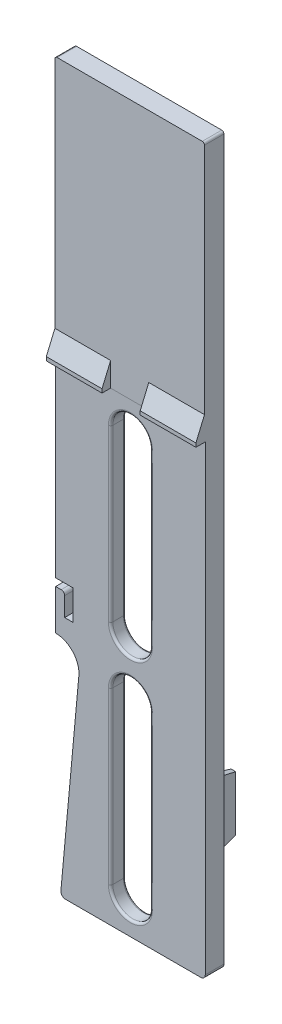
SolidWorks part; units mm, degrees
ref_plane "Front Plane" through (0, 0, 0) normal (0, 0, 1) x (1, 0, 0)
ref_plane "Top Plane" through (0, 0, 0) normal (0, 1, 0) x (1, 0, 0)
ref_plane "Right Plane" through (0, 0, 0) normal (1, 0, 0) x (0, 0, -1)
sketch "Sketch1" plane through (0, 0, 0) normal (0, 0, 1) x (1, 0, 0)
  line L0 (0, 0) -> (0, 100.3393) construction
  line L2 (-12.7, 123.19) -> (12.7, 123.19)
  line L3 (-12.7, 123.19) -> (-12.7, 0)
  line L4 (-12.7, 0) -> (12.7, 0)
  line L5 (12.7, 123.19) -> (12.7, 0)
  line L6 (-12.7, 123.19) -> (12.7, 0) construction
  line L7 (-12.7, 0) -> (12.7, 123.19) construction
  point P3 (0, 61.595)
  dimension "D1" = 25.4
  dimension "D2" = 123.19
extrude "Boss-Extrude1" add sketch "Sketch1" against normal blind 2.032
sketch "Sketch2" plane through (0, 0, -2.032) normal (0, 0, -1) x (-1, 0, 0)
  line L4 (-12.7, 123.19) -> (-12.7, 0)
  line L5 (-12.7, 0) -> (12.7, 0)
  line L6 (12.7, 0) -> (12.7, 123.19)
  line L7 (12.7, 123.19) -> (-12.7, 123.19)
  line L8 (-12.7, 123.19) -> (-12.7, 0)
  line L9 (-12.7, 0) -> (12.7, 0)
  line L10 (12.7, 0) -> (12.7, 123.19)
  line L11 (12.7, 123.19) -> (-12.7, 123.19)
  dimension "D1" = 0
extrude "Extrude-Thin1" add sketch "Sketch2" along normal offset from surface (1.143 mm away) 3.175 thin
sketch "Sketch3" plane through (0, 0, 0) normal (0, 0, 1) x (1, 0, 0)
  line L0 (0, 123.19) -> (0, 0) construction
  line L1 (12.7, 123.19) -> (-12.7, 123.19) construction
  line L2 (0, 34.7345) -> (0, 5.8293) construction
  line L3 (3.3655, 34.7345) -> (3.3655, 5.8293)
  line L4 (-3.3655, 34.7345) -> (-3.3655, 5.8293)
  line L5 (-12.7, 0) -> (12.7, 0) construction
  arc A0 (3.3655, 34.7345) -> (-3.3655, 34.7345) centre (0, 34.7345) ccw
  arc A1 (-3.3655, 5.8293) -> (3.3655, 5.8293) centre (0, 5.8293) ccw
  point P7 (0, 20.2819)
  point P12 (0, 0)
  dimension "D3" = 2.4638
  dimension "D1" = 6.731
  dimension "D2" = 35.6362
extrude "Cut-Extrude1" cut sketch "Sketch3" against normal through all
pattern_linear "LPattern1" count 2 spacing 38.608 along (0, 1, 0) of "Cut-Extrude1"
sketch "Sketch4" plane through (0, 0, 0) normal (0, 0, 1) x (1, 0, 0)
  line L0 (-11.8872, 0) -> (-8.763, 33.9877)
  line L1 (-12.7, 0) -> (12.7, 0) construction
  line L2 (-12.7, 38.3032) -> (-22.3348, 38.3032) construction
  line L3 (-12.7, 123.19) -> (-12.7, 0) construction
  line L4 (12.7, 0) -> (12.7, 123.19) construction
  arc A0 (-8.763, 33.9877) -> (-12.7, 38.3032) centre (-12.7, 34.3496) ccw
  dimension "D1" = 24.5872
  dimension "D2" = 38.3032
  dimension "D3" = 21.463
extrude "Cut-Extrude2" cut sketch "Sketch4" against normal through all and the other way through all
sketch "Sketch5" plane through (0, 0, 0) normal (0, 0, 1) x (1, 0, 0)
  line L0 (-12.7, 46.4312) -> (-9.7282, 46.4312)
  line L1 (-12.7, 123.19) -> (-12.7, 38.3032) construction
  line L2 (-9.7282, 46.4312) -> (-9.7282, 41.3512)
  line L3 (-9.7282, 41.3512) -> (-11.176, 41.3512)
  line L4 (-11.176, 41.3512) -> (-11.176, 45.1612)
  line L5 (-11.176, 45.1612) -> (-12.7, 45.1612)
  line L6 (-12.7, 45.1612) -> (-12.7, 46.4312)
  line L7 (-11.8872, 0) -> (12.7, 0) construction
  dimension "D1" = 1.27
  dimension "D2" = 1.4478
  dimension "D3" = 5.08
  dimension "D4" = 1.524
  dimension "D5" = 45.1612
extrude "Cut-Extrude3" cut sketch "Sketch5" against normal through all
sketch "Sketch6" plane through (0, 0, -2.032) normal (0, 0, -1) x (-1, 0, 0)
  line L0 (0, 0) -> (0, 133.807) construction
  line L1 (0, 6.0808) -> (0, 72.6186) construction
  line L2 (-7.1374, 6.0808) -> (-7.1374, 72.6186)
  line L3 (7.1374, 6.0808) -> (7.1374, 72.6186)
  line L4 (11.8872, 0) -> (-12.7, 0) construction
  line L5 (-8.7884, 6.0808) -> (-8.7884, 72.6186)
  line L6 (8.7884, 6.0808) -> (8.7884, 72.6186)
  arc A0 (-7.1374, 6.0808) -> (7.1374, 6.0808) centre (0, 6.0808) ccw
  arc A1 (7.1374, 72.6186) -> (-7.1374, 72.6186) centre (0, 72.6186) ccw
  arc A2 (8.7884, 72.6186) -> (-8.7884, 72.6186) centre (0, 72.6186) ccw
  arc A3 (-8.7884, 6.0808) -> (8.7884, 6.0808) centre (0, 6.0808) ccw
  point P5 (0, 39.3497)
  point P10 (0, 0)
  dimension "D3" = 79.756
  dimension "D1" = 14.2748
  dimension "D2" = 80.8126
  dimension "D4" = 1.651
extrude "Boss-Extrude2" add sketch "Sketch6" along normal up to surface (1.143 mm away)
sketch "Sketch7" plane through (0, 0, -3.175) normal (0, 0, -1) x (-1, 0, 0)
  line L1 (-6.3451, 0) -> (7.3026, 0)
  line L2 (-6.3451, 0) -> (-6.3451, -4.1989)
  line L3 (-6.3451, -4.1989) -> (7.3026, -4.1989)
  line L4 (7.3026, 0) -> (7.3026, -4.1989)
extrude "Cut-Extrude4" cut sketch "Sketch7" against normal through all
sketch "Sketch8" plane through (0, 0, -3.175) normal (0, 0, -1) x (-1, 0, 0)
  circle A0 centre (0, 6.0808) radius 7.1374
extrude "Cut-Extrude5" cut sketch "Sketch8" against normal up to surface (1.143 mm away)
fillet "Fillet1" radius 0.254 2 edges at (-3.7372, 0, -2.6035) (3.7372, 0, -2.6035)
sketch "Sketch9" plane through (0, 0, -2.032) normal (0, 0, -1) x (-1, 0, 0)
  line L0 (3.3655, 34.7345) -> (3.3655, 5.8293) construction
  line L1 (-3.3655, 5.8293) -> (-3.3655, 34.7345) construction
  line L2 (-3.3655, 44.4373) -> (-3.3655, 73.3425) construction
  line L3 (-7.1374, 72.6186) -> (-7.1374, 6.0808)
  line L4 (-4.5477, 0) -> (4.5477, 0)
  line L5 (7.1374, 6.0808) -> (7.1374, 72.6186)
  line L6 (-7.1374, 72.6186) -> (-7.1374, 6.0808)
  line L7 (-4.5477, 0) -> (4.5477, 0)
  line L8 (7.1374, 6.0808) -> (7.1374, 72.6186)
  line L9 (3.3655, 73.3425) -> (3.3655, 44.4373) construction
  line L10 (3.3655, 34.7345) -> (3.3655, 5.8293)
  line L11 (-3.3655, 5.8293) -> (-3.3655, 34.7345)
  line L12 (-3.3655, 44.4373) -> (-3.3655, 73.3425)
  line L13 (3.3655, 73.3425) -> (3.3655, 44.4373)
  arc A0 (-3.3655, 5.8293) -> (3.3655, 5.8293) centre (0, 5.8293) ccw construction
  arc A1 (-3.3655, 5.8293) -> (3.3655, 5.8293) centre (0, 5.8293) ccw
  arc A2 (3.3655, 34.7345) -> (-3.3655, 34.7345) centre (0, 34.7345) ccw construction
  arc A3 (-3.3655, 44.4373) -> (3.3655, 44.4373) centre (0, 44.4373) ccw construction
  arc A4 (3.3655, 34.7345) -> (-3.3655, 34.7345) centre (0, 34.7345) ccw
  arc A5 (-7.1374, 6.0808) -> (-4.3914, 0.4542) centre (0, 6.0808) ccw
  arc A6 (-4.5477, 0) -> (-4.3914, 0.4542) centre (-4.5477, 0.254) ccw
  arc A7 (4.3914, 0.4542) -> (4.5477, 0) centre (4.5477, 0.254) ccw
  arc A8 (4.3914, 0.4542) -> (7.1374, 6.0808) centre (0, 6.0808) ccw
  arc A9 (7.1374, 72.6186) -> (-7.1374, 72.6186) centre (0, 72.6186) ccw
  arc A10 (-7.1374, 6.0808) -> (-4.3914, 0.4542) centre (0, 6.0808) ccw
  arc A11 (-4.5477, 0) -> (-4.3914, 0.4542) centre (-4.5477, 0.254) ccw
  arc A12 (4.3914, 0.4542) -> (4.5477, 0) centre (4.5477, 0.254) ccw
  arc A13 (4.3914, 0.4542) -> (7.1374, 6.0808) centre (0, 6.0808) ccw
  arc A14 (7.1374, 72.6186) -> (-7.1374, 72.6186) centre (0, 72.6186) ccw
  arc A15 (-3.3655, 44.4373) -> (3.3655, 44.4373) centre (0, 44.4373) ccw
  arc A16 (3.3655, 73.3425) -> (-3.3655, 73.3425) centre (0, 73.3425) ccw construction
  arc A17 (3.3655, 73.3425) -> (-3.3655, 73.3425) centre (0, 73.3425) ccw
  dimension "D1" = 0
extrude "Boss-Extrude3" add sketch "Sketch9" along normal blind 0.508
sketch "Sketch10" plane through (0, 0, -2.032) normal (0, 0, -1) x (-1, 0, 0)
  line L0 (8.7884, 34.9243) -> (8.7884, 72.6186) construction
  line L1 (11.176, 37.9977) -> (11.176, 41.3512) construction
  line L2 (11.176, 41.3512) -> (9.7282, 41.3512) construction
  line L3 (9.7282, 41.3512) -> (9.7282, 46.4312) construction
  line L4 (9.7282, 46.4312) -> (11.176, 46.4312) construction
  line L5 (8.7884, 34.9243) -> (8.7884, 48.0822)
  line L6 (11.176, 37.9977) -> (11.176, 41.3512)
  line L7 (11.176, 41.3512) -> (9.7282, 41.3512)
  line L8 (9.7282, 41.3512) -> (9.7282, 46.4312)
  line L9 (9.7282, 46.4312) -> (11.176, 46.4312)
  line L10 (11.176, 46.4312) -> (11.176, 121.666) construction
  line L11 (11.176, 46.4312) -> (11.176, 48.0822)
  line L12 (11.176, 48.0822) -> (8.7884, 48.0822)
  arc A0 (11.176, 37.9977) -> (8.7884, 34.9243) centre (12.7, 34.3496) ccw construction
  arc A1 (11.176, 37.9977) -> (8.7884, 34.9243) centre (12.7, 34.3496) ccw
  dimension "D1" = 1.651
extrude "Boss-Extrude4" add sketch "Sketch10" along normal up to surface (1.143 mm away)
sketch "Sketch11" plane through (0, 0, -2.032) normal (0, 0, -1) x (-1, 0, 0)
  line L0 (8.7884, 72.6186) -> (8.7884, 121.666)
  line L1 (-8.7884, 72.6186) -> (-8.7884, 121.666)
  line L2 (11.176, 121.666) -> (-11.176, 121.666) construction
  line L3 (8.7884, 121.666) -> (7.1374, 121.666)
  line L4 (0, 0) -> (0, 145.7514) construction
  line L5 (-7.1374, 72.6186) -> (-7.1374, 121.666)
  line L7 (7.1374, 72.6186) -> (7.1374, 121.666)
  line L8 (-8.7884, 72.6186) -> (-7.1374, 72.6186)
  line L9 (7.1374, 72.6186) -> (8.7884, 72.6186)
  line L10 (-7.1374, 121.666) -> (-8.7884, 121.666)
  dimension "D1" = 1.651
  dimension "D2" = 1.651
extrude "Boss-Extrude5" add sketch "Sketch11" along normal up to surface (1.143 mm away)
sketch "Sketch12" plane through (0, 0, -2.032) normal (0, 0, -1) x (-1, 0, 0)
  line L0 (0, 0) -> (0, 135.5833) construction
  line L1 (0, 121.666) -> (0, 80.5241)
  line L2 (7.1374, 121.666) -> (-7.1374, 121.666) construction
  arc A1 (7.1374, 77.7463) -> (-7.1374, 77.7463) centre (0, 72.6186) ccw construction
  dimension "D1" = 7.9055
extrude "Extrude-Thin4" add sketch "Sketch12" along normal up to surface (1.143 mm away) thin
sketch "Sketch13" plane through (0, 0, -2.032) normal (0, 0, -1) x (-1, 0, 0)
  line L0 (9.9822, 48.0822) -> (9.9822, 56.894) construction
  line L1 (11.176, 48.0822) -> (8.7884, 48.0822) construction
  line L2 (9.9822, 50.8308) -> (-19.4969, 49.4381) construction
  circle A0 centre (9.9822, 50.8308) radius 1.3927
  circle A1 centre (-10.0834, 49.8828) radius 1.4426
extrude "Boss-Extrude6" add sketch "Sketch13" along normal up to surface (1.143 mm away)
sketch "Sketch14" plane through (0, 0, -2.032) normal (0, 0, -1) x (-1, 0, 0)
  line L4 (7.5148, 1.524) -> (11.176, 1.524)
  line L5 (11.176, 1.524) -> (11.176, 7.737)
  line L6 (11.176, 7.737) -> (8.7884, 33.7114)
  line L7 (8.7884, 33.7114) -> (8.7884, 6.0808)
  line L8 (7.5148, 1.524) -> (11.176, 1.524)
  line L9 (11.176, 1.524) -> (11.176, 7.737)
  line L10 (11.176, 7.737) -> (8.7884, 33.7114)
  line L11 (8.7884, 33.7114) -> (8.7884, 6.0808)
  arc A1 (7.5148, 1.524) -> (8.7884, 6.0808) centre (0, 6.0808) ccw
  arc A2 (7.5148, 1.524) -> (8.7884, 6.0808) centre (0, 6.0808) ccw
  dimension "D1" = 0
extrude "Boss-Extrude7" add sketch "Sketch14" along normal up to surface (1.143 mm away)
fillet "Fillet2" radius 0.381 16 edges at (0, 76.708, 0) (3.3655, 58.8899, 0) (0, 41.0718, 0) (0, 38.1, 0) (3.3655, 20.2819, 0) (0, 2.4638, 0) (0, 38.1, -2.54) (-3.3655, 20.2819, -2.54) (0, 2.4638, -2.54) (0, 76.708, -2.54) (-3.3655, 58.8899, -2.54) (0, 41.0718, -2.54) (-3.3655, 58.8899, 0) (-3.3655, 20.2819, 0) (3.3655, 20.2819, -2.54) (3.3655, 58.8899, -2.54)
sketch "Sketch15" plane through (0, 0, 0) normal (0, 0, 1) x (1, 0, 0)
  line L0 (-12.7, 123.19) -> (-12.7, 46.4312) construction
  line L1 (12.7, 123.19) -> (-12.7, 123.19) construction
  line L2 (12.7, 0) -> (12.7, 123.19) construction
  line L3 (-12.7, 123.19) -> (-12.7, 79.121)
  line L4 (12.7, 123.19) -> (-12.7, 123.19)
  line L5 (12.7, 79.121) -> (12.7, 123.19)
  line L6 (-12.7, 79.121) -> (12.7, 79.121)
  dimension "D1" = 44.069
extrude "Boss-Extrude8" add sketch "Sketch15" along normal blind 0.127
sketch "Sketch16" plane through (0, 0, 0) normal (1, 0, 0) x (0, 0, -1)
  line L0 (-0.127, 79.121) -> (-1.5875, 79.121)
  line L1 (-1.5875, 79.121) -> (-1.5875, 79.756)
  line L2 (-1.5875, 79.756) -> (-0.127, 83.185)
  line L3 (-0.127, 79.121) -> (-0.127, 123.19) construction
  line L4 (-0.127, 83.185) -> (-0.127, 79.121)
  line L5 (0, 0) -> (0, 79.121) construction
  dimension "D1" = 1.5875
  dimension "D2" = 0.635
  dimension "D3" = 4.064
extrude "Boss-Extrude9" add sketch "Sketch16" along normal up to surface and the other way up to surface
sketch "Sketch17" plane through (0, 123.19, 0) normal (0, 1, 0) x (1, 0, 0)
  line L0 (0, -0.127) -> (0, -13.26) construction
  line L1 (12.7, -0.127) -> (-12.7, -0.127) construction
  line L3 (-3.2385, -6.3417) -> (3.2385, -6.3417)
  line L4 (-3.2385, -6.3417) -> (-3.2385, -0.127)
  line L5 (-3.2385, -0.127) -> (3.2385, -0.127)
  line L6 (3.2385, -6.3417) -> (3.2385, -0.127)
  line L7 (-3.2385, -6.3417) -> (3.2385, -0.127) construction
  line L8 (-3.2385, -0.127) -> (3.2385, -6.3417) construction
  point P5 (0, -3.2343)
  dimension "D1" = 6.477
extrude "Cut-Extrude6" cut sketch "Sketch17" against normal through all
fillet "Fillet3" radius 0.5842 1 edges at (-11.176, 45.1612, -1.5875)
sketch "Sketch18" plane through (0, 0, -3.175) normal (0, 0, -1) x (-1, 0, 0)
  line L0 (-7.1374, 6.0808) -> (-7.1374, 72.6186) construction
  line L1 (-7.1374, 25.4) -> (-8.7884, 25.4)
  line L2 (-7.1374, 25.4) -> (-7.1374, 12.7)
  line L3 (-7.1374, 12.7) -> (-8.7884, 12.7)
  line L4 (-8.7884, 25.4) -> (-8.7884, 12.7)
  line L5 (-8.7884, 6.0808) -> (-8.7884, 49.2472) construction
  line L6 (-4.5477, 0) -> (-12.7, 0) construction
  dimension "D1" = 12.7
  dimension "D2" = 12.7
extrude "Boss-Extrude11" add sketch "Sketch18" along normal blind 6.35 draft 4
sketch "Sketch19" plane through (12.7, 0, 0) normal (1, 0, 0) x (0, 0, -1)
  line L0 (3.175, 12.7) -> (12.9126, 12.7)
  line L1 (3.175, 12.7) -> (11.2695, 14.8689)
  line L2 (11.2695, 14.8689) -> (12.9126, 12.7)
  line L3 (3.175, 25.4) -> (14.8026, 25.4)
  line L4 (3.175, 25.4) -> (12.7147, 22.8438)
  line L5 (12.7147, 22.8438) -> (14.8026, 25.4)
  dimension "D1" = 15
  dimension "D2" = 15
extrude "Cut-Extrude7" cut sketch "Sketch19" against normal through all
fillet "Fillet4" radius 0.762 2 edges at (-11.8872, 0, -1.5875) (12.7, 0, -1.5875)
fillet "Fillet5" radius 0.381 3 edges at (-12.7, 123.19, -1.524) (12.7, 123.19, -1.524)
sketch "Sketch20" plane through (0, 0, 0) normal (0, 0, 1) x (1, 0, 0)
  line L0 (-8.763, 33.9877) -> (-11.8107, 0.8318) construction
  line L1 (-8.763, 33.9877) -> (-11.8107, 0.8318)
  arc A0 (-8.763, 33.9877) -> (-12.7, 38.3032) centre (-12.7, 34.3496) ccw construction
  arc A1 (-8.763, 33.9877) -> (-12.7, 38.3032) centre (-12.7, 34.3496) ccw
extrude "Cut-Extrude8" cut sketch "Sketch20" against normal through all and the other way through all flip side to cut
